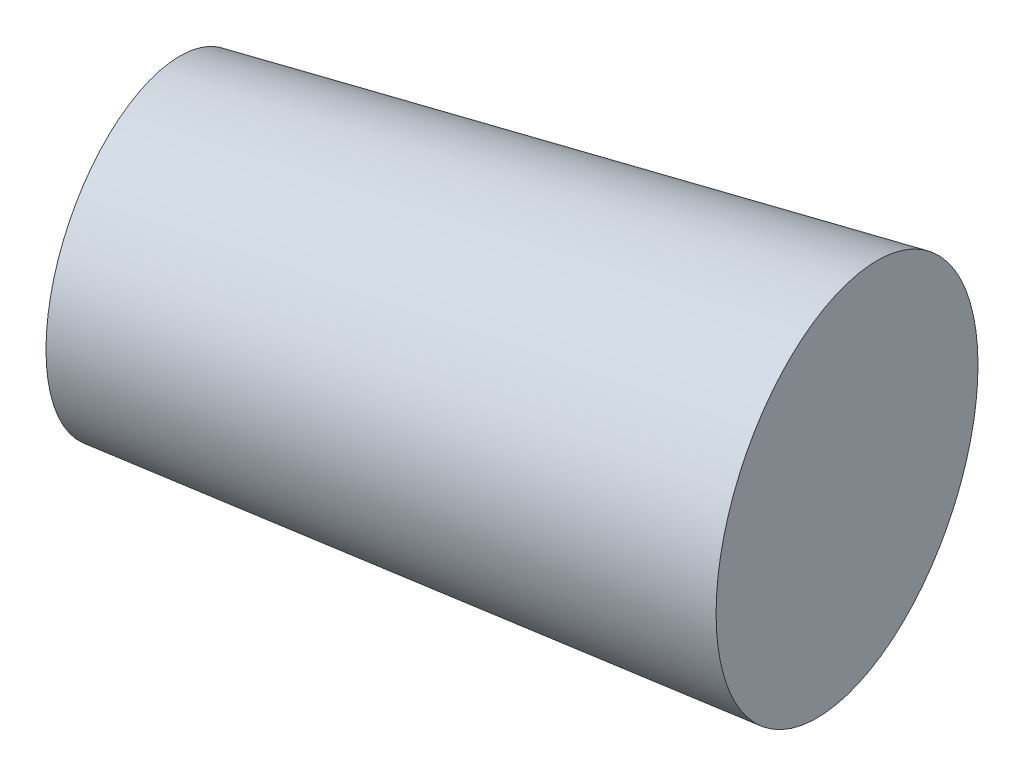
SolidWorks part; units mm, degrees
ref_plane "Plan1" through (0, 0, 0) normal (0, 0, 1) x (1, 0, 0)
ref_plane "Plan2" through (0, 0, 0) normal (0, 1, 0) x (1, 0, 0)
ref_plane "Plan3" through (0, 0, 0) normal (1, 0, 0) x (0, 0, -1)
sketch "Esquisse1" plane through (0, 0, 0) normal (0, 1, 0) x (1, 0, 0)
  line L1 (0, 0) -> (16, 3.8957) construction
  line L2 (0, 0) -> (16, 3.8957) construction
  line L4 (-11.7752, -8.2156) -> (-14.234, 1.883) construction
  line L5 (-14.234, 1.883) -> (5.0429, 7.6604) construction
  line L6 (8, -4.4848) -> (5.0429, 7.6604) construction
  line L7 (-13.0046, -3.1663) -> (6.5215, 1.5878)
  line L8 (-13.0046, -3.1663) -> (-14.234, 1.883)
  line L9 (-14.234, 1.883) -> (5.0429, 7.6604)
  line L10 (6.5215, 1.5878) -> (5.0429, 7.6604)
revolve "Base-Révolution" add sketch "Esquisse1" angle 360 about L2
